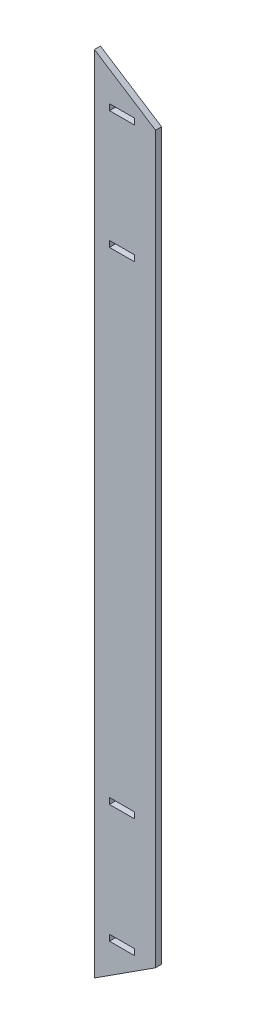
SolidWorks part; units mm, degrees
ref_plane "Front Plane" through (0, 0, 0) normal (0, 0, 1) x (1, 0, 0)
ref_plane "Top Plane" through (0, 0, 0) normal (0, 1, 0) x (1, 0, 0)
ref_plane "Right Plane" through (0, 0, 0) normal (1, 0, 0) x (0, 0, -1)
sketch "Sketch1" plane through (0, 0, 0) normal (0, 0, 1) x (1, 0, 0)
  line L1 (1.524, 9.9554) -> (1.524, -193.2446)
  line L2 (1.524, -193.2446) -> (16.9701, -183.2892)
  line L3 (16.9701, -183.2892) -> (16.9701, 0)
  line L4 (16.9701, 0) -> (1.524, 9.9554)
  line L5 (5.3198, 0) -> (11.6698, 0)
  line L6 (5.3198, 0) -> (5.3198, -1.524)
  line L7 (5.3198, -1.524) -> (11.6698, -1.524)
  line L8 (11.6698, 0) -> (11.6698, -1.524)
  line L9 (5.3198, -29.9283) -> (11.6698, -29.9283)
  line L10 (5.3198, -29.9283) -> (5.3198, -31.4523)
  line L11 (5.3198, -31.4523) -> (11.6698, -31.4523)
  line L12 (11.6698, -29.9283) -> (11.6698, -31.4523)
  line L13 (5.3198, -153.3609) -> (11.6698, -153.3609)
  line L14 (5.3198, -153.3609) -> (5.3198, -151.8369)
  line L15 (5.3198, -151.8369) -> (11.6698, -151.8369)
  line L16 (11.6698, -153.3609) -> (11.6698, -151.8369)
  line L17 (5.3198, -183.2892) -> (11.6698, -183.2892)
  line L18 (5.3198, -183.2892) -> (5.3198, -181.7652)
  line L19 (5.3198, -181.7652) -> (11.6698, -181.7652)
  line L20 (11.6698, -183.2892) -> (11.6698, -181.7652)
extrude "Boss-Extrude1" add sketch "Sketch1" along normal blind 1.524
